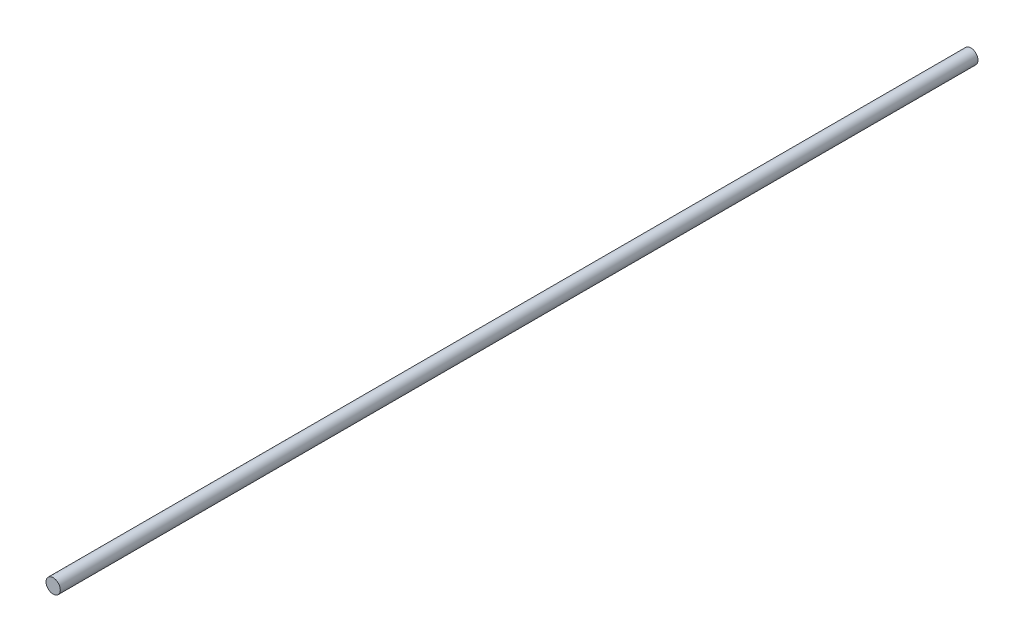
SolidWorks part; units mm, degrees
ref_plane "Front Plane" through (0, 0, 0) normal (0, 0, 1) x (1, 0, 0)
ref_plane "Top Plane" through (0, 0, 0) normal (0, 1, 0) x (1, 0, 0)
ref_plane "Right Plane" through (0, 0, 0) normal (1, 0, 0) x (0, 0, -1)
sketch "Sketch1" plane through (0, 0, 0) normal (0, 0, 1) x (1, 0, 0)
  circle A0 centre (0, 0) radius 30
  dimension "D1" = 60
extrude "Boss-Extrude1" add sketch "Sketch1" against normal blind 3850
